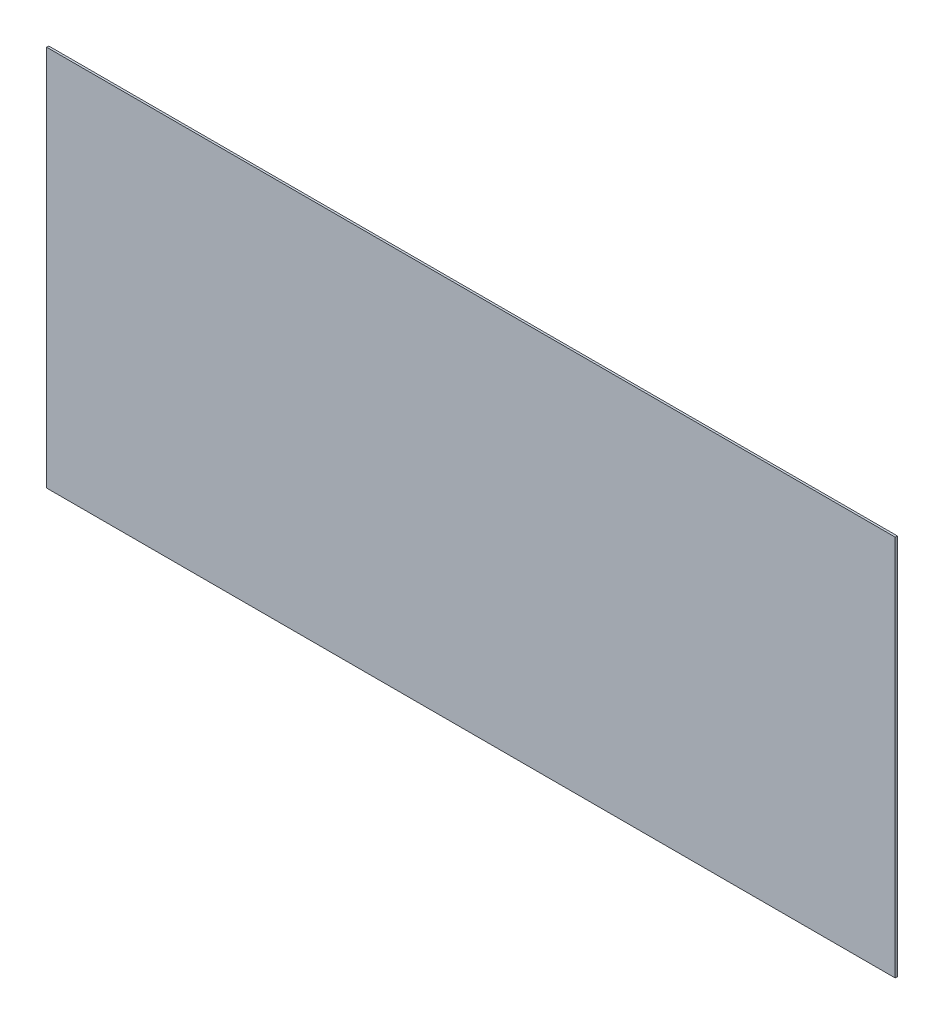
SolidWorks part; units mm, degrees
ref_plane "Plan de face" through (0, 0, 0) normal (0, 0, 1) x (1, 0, 0)
ref_plane "Plan de dessus" through (0, 0, 0) normal (0, 1, 0) x (1, 0, 0)
ref_plane "Plan de droite" through (0, 0, 0) normal (1, 0, 0) x (0, 0, -1)
sketch "Esquisse1" plane through (0, 0, 0) normal (0, 0, 1) x (1, 0, 0)
  line L1 (0, 0) -> (2000, 0)
  line L2 (0, 0) -> (0, 900)
  line L3 (0, 900) -> (2000, 900)
  line L4 (2000, 0) -> (2000, 900)
  dimension "D1" = 900
  dimension "D2" = 2000
extrude "Extrusion1" add sketch "Esquisse1" along normal blind 5
